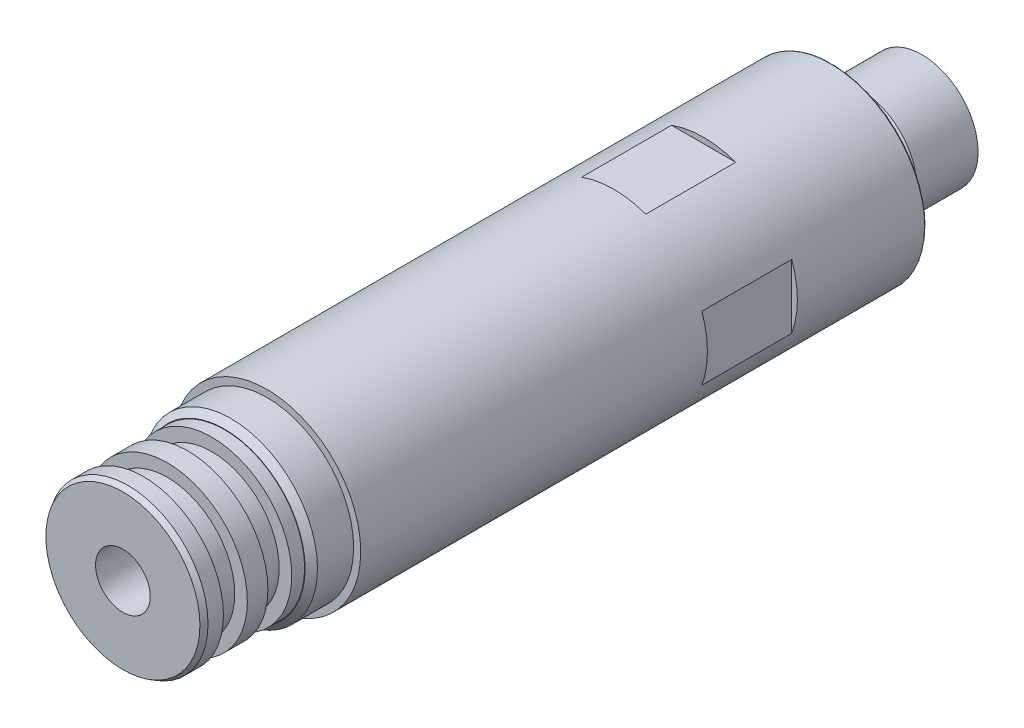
SolidWorks part; units mm, degrees
ref_plane "Plane1" through (0, 0, 0) normal (0, 0, 1) x (1, 0, 0)
ref_plane "Plane2" through (0, 0, 0) normal (0, 1, 0) x (1, 0, 0)
ref_plane "Plane3" through (0, 0, 0) normal (1, 0, 0) x (0, 0, -1)
sketch "Sketch1" plane through (0, 0, 0) normal (0, 0, 1) x (1, 0, 0)
  circle A0 centre (0, 0) radius 9.271
  dimension "D1" = 18.542
extrude "Base-Extrude" add sketch "Sketch1" along normal blind 55.88
sketch "Sketch2" plane through (0, 0, 0) normal (0, 0, -1) x (-1, 0, 0)
  circle A0 centre (0, 0) radius 5.5562
  dimension "D1" = 11.1125
extrude "threaded_base" add sketch "Sketch2" along normal blind 8.89
sketch "Sketch5"
  circle A0 centre (0, 0) radius 8.5725
  dimension "D1" = 17.145
extrude "thru_hole" cut sketch "Sketch3" against normal through all
sketch "Sketch3" plane through (0, 0, -8.89) normal (0, 0, -1) x (-1, 0, 0)
  circle A0 centre (0, 0) radius 1.5875
  dimension "D1" = 3.175
extrude "ortman_base" add sketch "Sketch5" along normal blind 1.27
sketch "Sketch6" plane through (0, 0, 57.15) normal (0, 0, 1) x (1, 0, 0)
  circle A0 centre (0, 0) radius 8.5725
  dimension "D1" = 17.145
extrude "ortman_groove" add sketch "Sketch6" along normal blind 1.651
sketch "Sketch7" plane through (0, 0, 58.801) normal (0, 0, 1) x (1, 0, 0)
  circle A0 centre (0, 0) radius 8.5725
  dimension "D1" = 17.145
extrude "ortman_2" add sketch "Sketch7" along normal blind 1.27
sketch "Sketch8" plane through (0, 0, 60.071) normal (0, 0, 1) x (1, 0, 0)
  circle A0 centre (0, 0) radius 7.9121
  dimension "D1" = 15.8242
extrude "oring_base" add sketch "Sketch8" along normal blind 1.27
sketch "Sketch9" plane through (0, 0, 61.341) normal (0, 0, 1) x (1, 0, 0)
  circle A0 centre (0, 0) radius 6.6675
  dimension "D1" = 13.335
extrude "oring_groove" add sketch "Sketch9" along normal blind 2.3622
sketch "Sketch10" plane through (0, 0, 63.7032) normal (0, 0, 1) x (1, 0, 0)
  circle A0 centre (0, 0) radius 7.9121
  dimension "D1" = 15.8242
extrude "oring_base2" add sketch "Sketch10" along normal blind 2.032
sketch "Sketch12" plane through (0, 0, 65.7352) normal (0, 0, 1) x (1, 0, 0)
  circle A0 centre (0, 0) radius 6.6675
  dimension "D1" = 13.335
extrude "oring_groove_2" add sketch "Sketch12" along normal blind 2.3622
sketch "Sketch13" plane through (0, 0, 68.0974) normal (0, 0, 1) x (1, 0, 0)
  circle A0 centre (0, 0) radius 7.9121
  dimension "D1" = 15.8242
extrude "oring_base_3" add sketch "Sketch13" along normal blind 2.032
chamfer "Chamfer2" distance 0.508 angle 30 1 edges at (7.9121, 0, 70.1294)
sketch "Sketch14" plane through (0, 0, 70.1294) normal (0, 0, 1) x (1, 0, 0)
  circle A0 centre (0, 0) radius 2.7051
  dimension "D1" = 5.4102
extrude "Cut-Extrude1" cut sketch "Sketch14" against normal blind 15.24
ref_plane "mill_plane" through (0, 0, 12.7) normal (0, 0, 1) x (1, 0, 0)
sketch "Sketch15" plane through (0, 0, 12.7) normal (0, 0, 1) x (1, 0, 0)
  line L0 (0, 0) -> (0, 8.7122) construction
  line L1 (0, 0) -> (8.7122, 0) construction
  line L2 (0, 8.7122) -> (8.7122, 8.7122)
  line L3 (8.7122, -8.7122) -> (8.7122, 8.7122)
  line L4 (-8.7122, -8.7122) -> (-8.7122, 8.7122)
  line L5 (0, 8.7122) -> (-8.7122, 8.7122)
  line L6 (0, -8.7122) -> (-8.7122, -8.7122)
  line L7 (0, -8.7122) -> (8.7122, -8.7122)
  point P8 (-8.7122, 0)
  dimension "D1" = 8.7122
  dimension "D2" = 8.7122
extrude "Cut-Extrude2" cut sketch "Sketch15" along normal blind 8.89 flip side to cut
chamfer "Chamfer4" distance 0.6096 angle 45 1 edges at (8.5725, 0, 60.071)
sketch "Sketch16" plane through (0, 0, 0) normal (0, 0, -1) x (-1, 0, 0)
  circle A0 centre (0, 0) radius 4.6228
  dimension "D1" = 9.2456
extrude "boss_seat" cut sketch "Sketch16" along normal blind 1.905 flip side to cut
fillet "boss_radius" radius 0.635 1 edges at (-4.6228, 0, 0)
chamfer "Chamfer5" distance 0.9271 angle 45 1 edges at (-5.5562, 0, -1.905)
fillet "Fillet1" radius 0.381 1 edges at (-4.6228, 0, -1.905)
fillet "Fillet3" radius 0.127 1 edges at (9.271, 0, 0)
